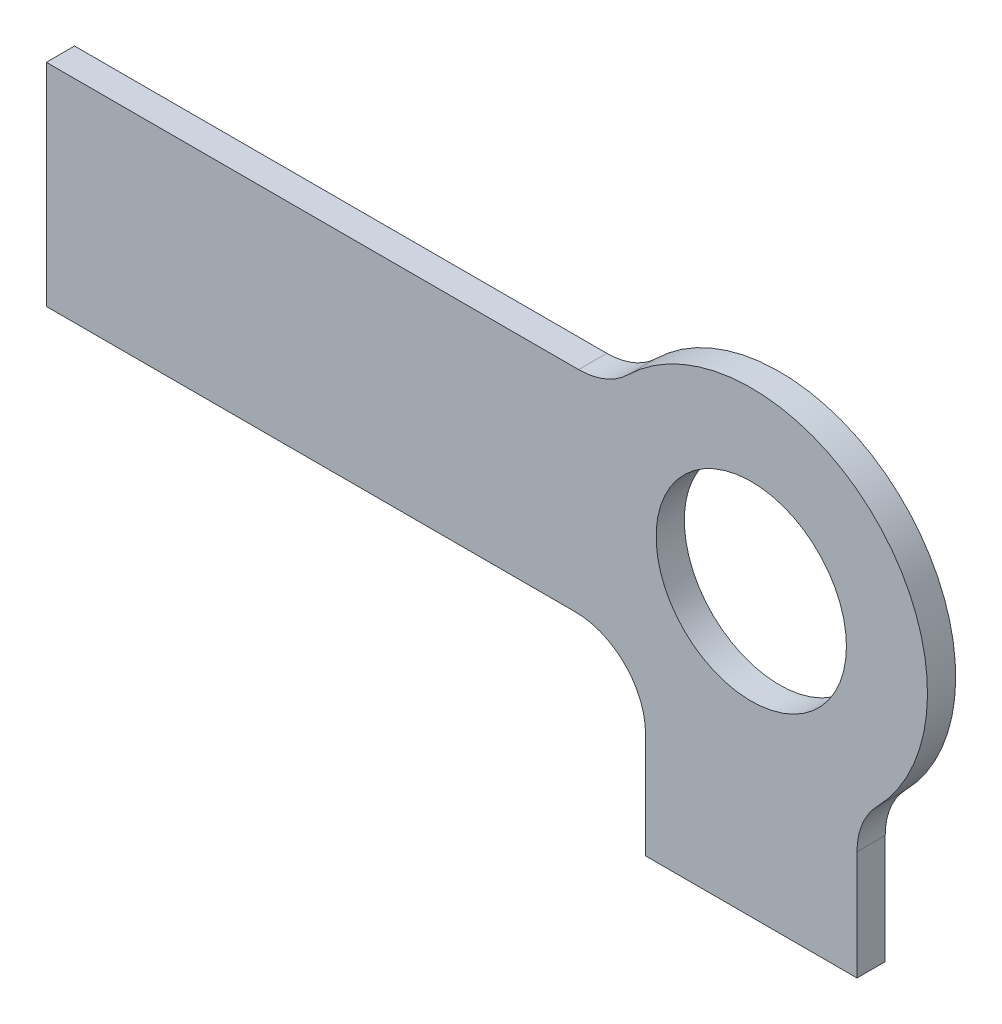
SolidWorks part; units mm, degrees
ref_plane "Front" through (0, 0, 0) normal (0, 0, 1) x (1, 0, 0)
ref_plane "Top" through (0, 0, 0) normal (0, 1, 0) x (1, 0, 0)
ref_plane "Right" through (0, 0, 0) normal (1, 0, 0) x (0, 0, -1)
sketch "Sketch1" plane through (0, 0, 0) normal (0, 0, 1) x (1, 0, 0)
  line L0 (-10, 1.5) -> (-2.4495, 1.5)
  line L1 (-10, -1.5) -> (-2.5, -1.5)
  line L2 (-1.5, -2.5) -> (-1.5, -4)
  line L3 (1.5, -4) -> (1.5, -2.4495)
  line L4 (-10, 1.5) -> (-10, -1.5)
  line L5 (-1.5, -4) -> (1.5, -4)
  circle A1 centre (0, 0) radius 1.35
  arc A2 (-2.4495, 1.5) -> (-1.7496, 1.7857) centre (-2.4495, 2.5) ccw
  arc A3 (-1.5, -2.5) -> (-2.5, -1.5) centre (-2.5, -2.5) ccw
  arc A4 (1.7857, -1.7496) -> (1.5, -2.4495) centre (2.5, -2.4495) ccw
  arc A5 (1.7857, -1.7496) -> (-1.7496, 1.7857) centre (0, 0) ccw
  dimension "d" = 2.7
  dimension "D0" = 5
  dimension "r" = 1
  dimension "B" = 3
  dimension "D4" = 3
  dimension "D5" = 1.5
  dimension "D6" = 1.5
  dimension "L" = 10
  dimension "L1" = 4
extrude "Base-Extrude" add sketch "Sketch1" against normal blind 0.4
equation "\"D5@Sketch1\" = \"B@Sketch1\" / 2"
equation "\"D4@Sketch1\" = \"B@Sketch1\""
equation "\"D6@Sketch1\" = \"B@Sketch1\" / 2"
